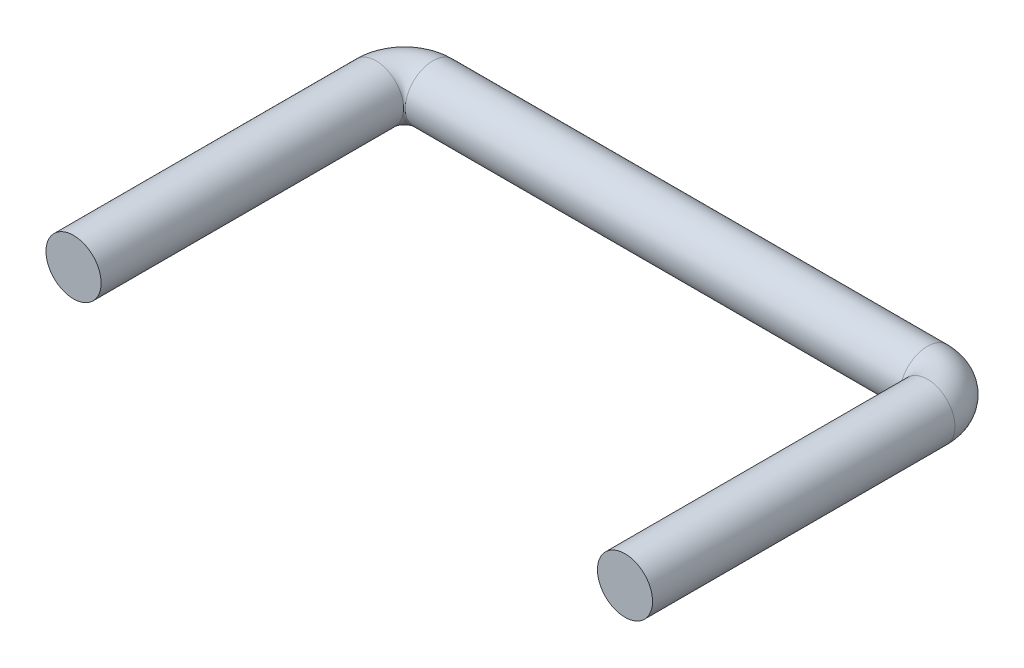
SolidWorks part; units mm, degrees
ref_plane "Front Plane" through (0, 0, 0) normal (0, 0, 1) x (1, 0, 0)
ref_plane "Top Plane" through (0, 0, 0) normal (0, 1, 0) x (1, 0, 0)
ref_plane "Right Plane" through (0, 0, 0) normal (1, 0, 0) x (0, 0, -1)
sketch "Sketch1" plane through (0, 0, 0) normal (0, 1, 0) x (1, 0, 0)
  line L0 (-26.9737, 28.6552) -> (-26.9737, 37.3636)
  line L1 (-26.1571, 38.1802) -> (-11.9153, 38.1802)
  line L2 (-11.0987, 37.3636) -> (-11.0987, 28.6552)
  arc A0 (-26.1571, 38.1802) -> (-26.9737, 37.3636) centre (-26.1571, 37.3636) ccw
  arc A1 (-11.0987, 37.3636) -> (-11.9153, 38.1802) centre (-11.9153, 37.3636) ccw
  point P6 (-26.9737, 38.1802)
  point P9 (-11.0987, 38.1802)
  dimension "D4" = 0.8166
  dimension "D1" = 9.525
  dimension "D2" = 9.525
  dimension "D3" = 15.875
curve "CompCurve1"
ref_plane "Plane2" through (-26.9737, 0, -28.6552) normal (0, 0, -1) x (-1, 0, 0)
sketch "Sketch2" plane through (-26.9737, 0, -28.6552) normal (0, 0, -1) x (-1, 0, 0)
  circle A0 centre (0.0026, 0) radius 0.7937
  dimension "D1" = 1.5875
sweep "Sweep1" add profiles "Sketch2" path "CompCurve1"
